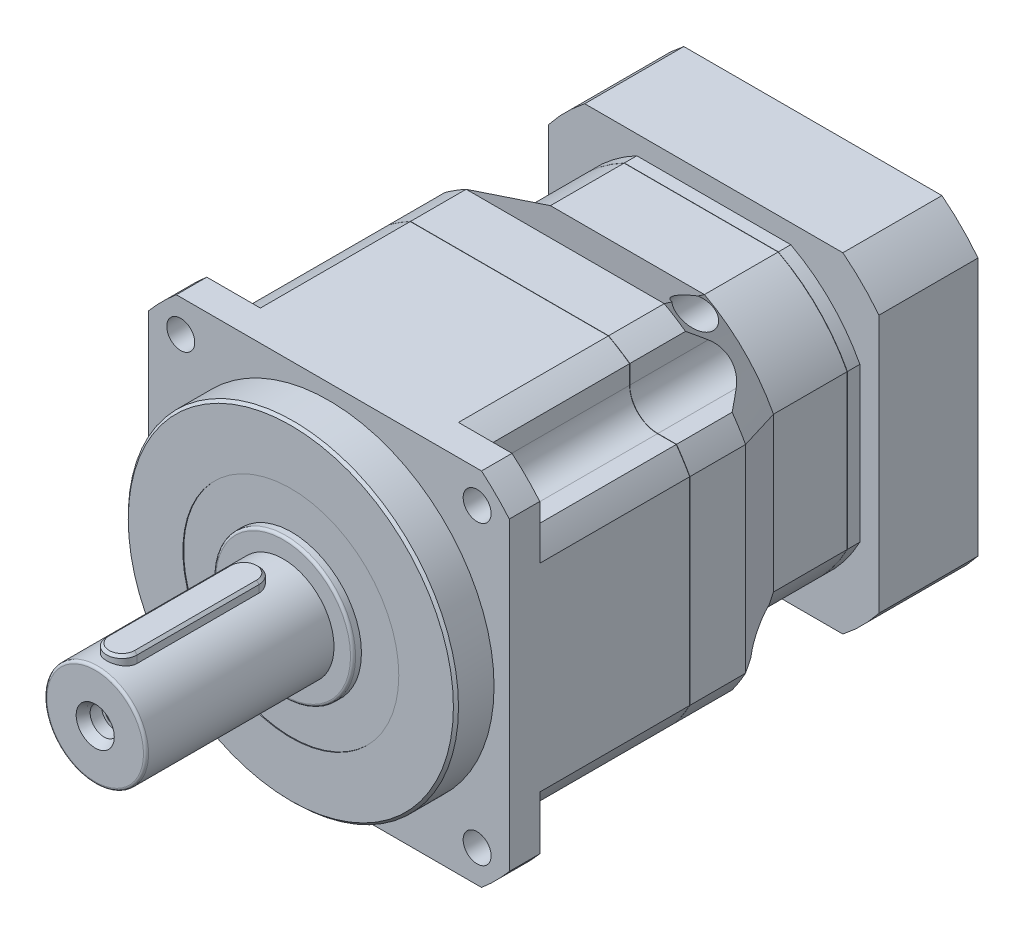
SolidWorks part; units mm, degrees
ref_plane "前视基准面" through (0, 0, 0) normal (0, 0, 1) x (1, 0, 0)
ref_plane "上视基准面" through (0, 0, 0) normal (0, 1, 0) x (1, 0, 0)
ref_plane "右视基准面" through (0, 0, 0) normal (1, 0, 0) x (0, 0, -1)
sketch "草图1" plane through (0, 0, 0) normal (0, 0, 1) x (1, 0, 0)
  line L1 (-60.0666, 71) -> (60.0666, 71)
  line L2 (-71, 60.0666) -> (-71, -60.0666)
  line L3 (-60.0666, -71) -> (60.0666, -71)
  line L4 (71, 60.0666) -> (71, -60.0666)
  arc A0 (-60.0666, 71) -> (-71, 60.0666) centre (0, 0) ccw
  arc A1 (-71, -60.0666) -> (-60.0666, -71) centre (0, 0) ccw
  arc A2 (60.0666, -71) -> (71, -60.0666) centre (0, 0) ccw
  arc A3 (71, 60.0666) -> (60.0666, 71) centre (0, 0) ccw
  dimension "D1" = 71
  dimension "D3" = 71
extrude "凸台-拉伸1" add sketch "草图1" along normal blind 12
sketch "草图2" plane through (0, 0, 12) normal (0, 0, 1) x (1, 0, 0)
  circle A0 centre (0, 0) radius 65
extrude "凸台-拉伸2" add sketch "草图2" along normal blind 15
sketch "草图3" plane through (0, 0, 0) normal (0, 0, -1) x (-1, 0, 0)
  line L0 (-60.0666, 71) -> (60.0666, 71) construction
  line L1 (71, 60.0666) -> (71, -60.0666) construction
  line L2 (60.0666, -71) -> (-60.0666, -71) construction
  line L3 (-71, -60.0666) -> (-71, 60.0666) construction
  line L4 (-38.9872, 71) -> (38.9872, 71)
  line L5 (71, 38.9872) -> (71, -38.9872)
  line L6 (38.9872, -71) -> (-38.9872, -71)
  line L7 (-71, -38.9872) -> (-71, 38.9872)
  arc A0 (-38.9872, 71) -> (-71, 38.9872) centre (0, 0) ccw
  arc A1 (-71, -38.9872) -> (-38.9872, -71) centre (0, 0) ccw
  arc A2 (38.9872, -71) -> (71, -38.9872) centre (0, 0) ccw
  arc A3 (71, 38.9872) -> (38.9872, 71) centre (0, 0) ccw
extrude "凸台-拉伸3" add sketch "草图3" along normal blind 59
sketch "草图4" plane through (0, 0, -59) normal (0, 0, -1) x (-1, 0, 0)
  line L1 (-78.3152, 74.0927) -> (-47.35, 74.0927)
  line L2 (-78.3152, 74.0927) -> (-78.3152, 47.35)
  line L3 (-78.3152, 47.35) -> (-47.35, 47.35)
  line L4 (-47.35, 74.0927) -> (-47.35, 47.35)
  dimension "D1" = 47.35
  dimension "D2" = 47.35
extrude "切除-拉伸1" cut sketch "草图4" against normal up to surface (59 mm away)
pattern_circular "阵列(圆周)1" count 4 over 360 about axis through (0, 0, 0) along (0, 0, 1) of "切除-拉伸1"
fillet "圆角1" radius 11 4 edges at (47.35, -47.35, -29.5) (-47.35, -47.35, -29.5) (-47.35, 47.35, -29.5) (47.35, 47.35, -29.5)
ref_plane "基准面1" through (0, 0, -59.1) normal (0, 0, -1) x (-1, 0, 0)
sketch "草图5" plane through (0, 0, -59.1) normal (0, 0, -1) x (-1, 0, 0)
  line L0 (38.9872, 71) -> (-38.9872, 71) construction
  line L1 (71, -38.9872) -> (71, 38.9872) construction
  line L2 (-38.9872, -71) -> (38.9872, -71) construction
  line L3 (-71, 38.9872) -> (-71, -38.9872) construction
  line L4 (38.9872, 71) -> (-38.9872, 71)
  line L5 (71, -38.9872) -> (71, 38.9872)
  line L6 (-38.9872, -71) -> (38.9872, -71)
  line L7 (-71, 38.9872) -> (-71, -38.9872)
  arc A0 (-38.9872, 71) -> (-71, 38.9872) centre (0, 0) ccw
  arc A1 (-71, -38.9872) -> (-38.9872, -71) centre (0, 0) ccw
  arc A2 (38.9872, -71) -> (71, -38.9872) centre (0, 0) ccw
  arc A3 (71, 38.9872) -> (38.9872, 71) centre (0, 0) ccw
extrude "凸台-拉伸4" add sketch "草图5" along normal blind 21.9 separate body
ref_plane "基准面4" through (0, 0, -105.5) normal (0, 0, -1) x (-1, 0, 0)
sketch "草图25" plane through (0, 0, -105.5) normal (0, 0, -1) x (-1, 0, 0)
  line L1 (-30.3109, 57.5) -> (30.3109, 57.5)
  line L2 (-57.5, 30.3109) -> (-57.5, -30.3109)
  line L3 (-30.3109, -57.5) -> (30.3109, -57.5)
  line L4 (57.5, 30.3109) -> (57.5, -30.3109)
  arc A0 (-30.3109, 57.5) -> (-57.5, 30.3109) centre (0, 0) ccw
  arc A1 (-57.5, -30.3109) -> (-30.3109, -57.5) centre (0, 0) ccw
  arc A2 (30.3109, -57.5) -> (57.5, -30.3109) centre (0, 0) ccw
  arc A3 (57.5, 30.3109) -> (30.3109, 57.5) centre (0, 0) ccw
  dimension "D1" = 57.5
  dimension "D3" = 57.5
extrude "凸台-拉伸12" add sketch "草图25" along normal blind 29 separate body
loft "放样1" add
sketch "草图6" plane through (0, 0, -59.1) normal (0, 0, 1) x (1, 0, 0)
  line L0 (58.35, -47.35) -> (65.7189, -47.35) construction
  line L1 (47.35, -65.7189) -> (47.35, -58.35) construction
  line L2 (58.35, -47.35) -> (65.7189, -47.35)
  line L3 (47.35, -65.7189) -> (47.35, -58.35)
  arc A0 (58.35, -47.35) -> (47.35, -58.35) centre (58.35, -58.35) ccw construction
  arc A1 (58.35, -47.35) -> (47.35, -58.35) centre (58.35, -58.35) ccw
  arc A2 (47.35, -65.7189) -> (65.7189, -47.35) centre (0, 0) ccw
extrude "切除-拉伸2" cut sketch "草图6" against normal blind 50
pattern_circular "阵列(圆周)2" count 4 over 360 about axis through (0, 0, 0) along (0, 0, 1) of "切除-拉伸2"
ref_plane "基准面2" through (0, 0, -134.6) normal (0, 0, -1) x (-1, 0, 0)
sketch "草图7" plane through (0, 0, -134.6) normal (0, 0, -1) x (-1, 0, 0)
  line L1 (-30.3109, 57.5) -> (30.3109, 57.5)
  line L2 (-57.5, 30.3109) -> (-57.5, -30.3109)
  line L3 (-30.3109, -57.5) -> (30.3109, -57.5)
  line L4 (57.5, 30.3109) -> (57.5, -30.3109)
  arc A0 (-30.3109, 57.5) -> (-57.5, 30.3109) centre (0, 0) ccw
  arc A1 (-57.5, -30.3109) -> (-30.3109, -57.5) centre (0, 0) ccw
  arc A2 (30.3109, -57.5) -> (57.5, -30.3109) centre (0, 0) ccw
  arc A3 (57.5, 30.3109) -> (30.3109, 57.5) centre (0, 0) ccw
  dimension "D5" = 115
  dimension "D2" = 65
  dimension "D1" = 57.5
  dimension "D3" = 57.5
  dimension "D4" = 57.5
extrude "凸台-拉伸5" add sketch "草图7" along normal blind 4.9 separate body
sketch "草图8" plane through (0, 0, -139.5) normal (0, 0, -1) x (-1, 0, 0)
  line L1 (-65, 65) -> (65, 65)
  line L2 (-65, 65) -> (-65, -65)
  line L3 (-65, -65) -> (65, -65)
  line L4 (65, 65) -> (65, -65)
  dimension "D1" = 65
  dimension "D2" = 130
  dimension "D3" = 65
  dimension "D4" = 130
extrude "凸台-拉伸6" add sketch "草图8" along normal blind 39
sketch "草图9" plane through (0, 0, -178.5) normal (0, 0, -1) x (-1, 0, 0)
  circle A0 centre (0, 0) radius 82.5
extrude "切除-拉伸3" cut sketch "草图9" against normal up to surface (39 mm away) flip side to cut
sketch "草图10" plane through (0, 0, -178.5) normal (0, 0, -1) x (-1, 0, 0)
  circle A0 centre (0, 0) radius 55
extrude "切除-拉伸4" cut sketch "草图10" against normal blind 11
sketch "草图26" plane through (0, 0, -167.5) normal (0, 0, -1) x (-1, 0, 0)
  circle A0 centre (0, 0) radius 54.5
extrude "切除-拉伸12" cut sketch "草图26" against normal blind 8.5
sketch "草图27" plane through (0, 0, -178.5) normal (0, 0, -1) x (-1, 0, 0)
  line L0 (0, 0) -> (0, -47.5) construction
  line L1 (0, 0) -> (-25.1712, -40.2823) construction
  circle A0 centre (0, 0) radius 47.5 construction
  circle A1 centre (-25.1712, -40.2823) radius 7
  dimension "D1" = 32
extrude "切除-拉伸13" cut sketch "草图27" against normal blind 32.5
pattern_circular "阵列(圆周)7" count 6 over 360 about axis through (0, 0, 0) along (0, 0, 1) of "切除-拉伸13"
sketch "草图28" plane through (0, 0, -159) normal (0, 0, -1) x (-1, 0, 0)
  circle A0 centre (0, 0) radius 37
extrude "切除-拉伸14" cut sketch "草图28" against normal blind 21
ref_plane "基准面5" through (0, 0, -158.5) normal (0, 0, -1) x (-1, 0, 0)
sketch "草图29" plane through (0, 0, -158.5) normal (0, 0, -1) x (-1, 0, 0)
  circle A0 centre (0, 0) radius 32
extrude "凸台-拉伸13" add sketch "草图29" against normal up to surface (20.5 mm away)
chamfer "倒角4" distance 1.5 angle 45 1 edges at (-32, 0, -158.5)
sketch "草图30" plane through (0, 0, -178.5) normal (0, 0, -1) x (-1, 0, 0)
  circle A0 centre (0, 0) radius 12
extrude "切除-拉伸15" cut sketch "草图30" against normal blind 65.5
sketch "草图31" plane through (0, 0, -158.5) normal (0, 0, -1) x (-1, 0, 0)
  line L1 (-33.8172, 0.5) -> (34.9458, 0.5)
  line L2 (-33.8172, 0.5) -> (-33.8172, -0.5)
  line L3 (-33.8172, -0.5) -> (34.9458, -0.5)
  line L4 (34.9458, 0.5) -> (34.9458, -0.5)
  dimension "D1" = 0.5
  dimension "D2" = 1
extrude "切除-拉伸16" cut sketch "草图31" against normal up to surface (20.5 mm away)
sketch "草图32" plane through (0, 0, -146) normal (0, 0, -1) x (-1, 0, 0)
  line L1 (-45.8791, 4.7344) -> (-49.3395, 4.5747)
  line L2 (-49.3395, 4.5747) -> (-50.9315, 1.4981)
  line L3 (-50.9315, 1.4981) -> (-49.063, -1.4189)
  line L4 (-49.063, -1.4189) -> (-45.6026, -1.2593)
  line L5 (-45.6026, -1.2593) -> (-44.0106, 1.8174)
  line L6 (-44.0106, 1.8174) -> (-45.8791, 4.7344)
  circle A0 centre (-47.4711, 1.6577) radius 6
  circle A1 centre (-47.4711, 1.6577) radius 3 construction
  dimension "D1" = 6
extrude "凸台-拉伸14" add sketch "草图32" along normal blind 7
sketch "草图33" plane through (0, 0, -178.5) normal (0, 0, -1) x (-1, 0, 0)
  line L0 (0, 0) -> (-51.2652, 51.2652) construction
  circle A0 centre (0, 0) radius 72.5 construction
pattern_circular "阵列(圆周)8" count 6 over 360 about axis through (0, 0, 0) along (0, 0, 1) of "凸台-拉伸14"
hole_wizard "M8 螺纹孔1" positions "3D草图2" profile "草图34" tap size "M8" standard "GB"
sketch3d "3D草图2"
  point P0 (51.2652, 51.2652, -178.5)
sketch "草图34" plane through (51.2652, 51.2652, -178.5) normal (1, 0, 0) x (0, 1, 0)
  line L0 (0, 0) -> (0, 30.0429)
  line L1 (0, 30.0429) -> (3.4, 28)
  line L2 (3.4, 28) -> (3.4, 0)
  line L5 (3.4, 0) -> (0, 0)
  line L10 (0, 30.0429) -> (-3.4, 28) construction
  line L11 (0, -6.35) -> (0, 107.95) construction
  dimension "螺纹孔钻头直径" = 6.8
  dimension "螺纹孔钻头深度" = 28
  dimension "导头角度" = 118
pattern_circular "阵列(圆周)9" count 4 over 360 about axis through (0, 0, 0) along (0, 0, 1) of "M8 螺纹孔1"
chamfer "倒角2" distance 1 angle 45 1 edges at (65, 0, 27)
sketch "草图19" plane through (0, 0, 12) normal (0, 0, 1) x (1, 0, 0)
  line L0 (0, 0) -> (-65.7609, 65.7609) construction
  circle A0 centre (0, 0) radius 82.5 construction
  arc A1 (-60.0666, 71) -> (-71, 60.0666) centre (0, 0) ccw construction
  circle A2 centre (-58.3363, 58.3363) radius 5.5
extrude "切除-拉伸10" cut sketch "草图19" against normal blind 83.5
pattern_circular "阵列(圆周)5" count 4 over 360 about axis through (0, 0, 0) along (0, 0, 1) of "切除-拉伸10"
sketch "草图20" plane through (0, 0, 27) normal (0, 0, 1) x (1, 0, 0)
  circle A0 centre (0, 0) radius 27.5
extrude "凸台-拉伸8" add sketch "草图20" along normal blind 3
fillet "圆角3" radius 1 1 edges at (27.5, 0, 30)
sketch "草图21" plane through (0, 0, 30) normal (0, 0, 1) x (1, 0, 0)
  circle A0 centre (0, 0) radius 20
extrude "凸台-拉伸9" add sketch "草图21" along normal blind 74
fillet "圆角4" radius 1 1 edges at (20, 0, 104)
sketch "草图22" plane through (0, 0, 27) normal (0, 0, 1) x (1, 0, 0)
  circle A0 centre (0, 0) radius 42.5
  circle A1 centre (0, 0) radius 27.5
extrude "切除-拉伸11" cut sketch "草图22" against normal blind 0.3
sketch "草图23" plane through (0, 0, 0) normal (0, 1, 0) x (1, 0, 0)
  line L0 (-19, -104) -> (19, -104) construction
  line L1 (-6, -93.5) -> (-6, -45.5)
  line L2 (6, -45.5) -> (6, -93.5)
  arc A0 (-6, -93.5) -> (6, -93.5) centre (0, -93.5) ccw
  arc A1 (6, -45.5) -> (-6, -45.5) centre (0, -45.5) ccw
  dimension "D1" = 10.5
  dimension "D2" = 48
extrude "凸台-拉伸10" add sketch "草图23" along normal blind 23
chamfer "倒角3" distance 1 angle 45 4 edges at (-6, 23, 69.5) (0, 23, 99.5) (0, 23, 39.5) (6, 23, 69.5)
ref_plane "基准面6" through (0, 0, -73) normal (0, 0, -1) x (-1, 0, 0)
sketch "草图35" plane through (0, 0, -73) normal (0, 0, -1) x (-1, 0, 0)
  line L0 (0, 0) -> (0, 72.5) construction
  line L1 (0, 0) -> (-38.4191, 61.4835) construction
  circle A0 centre (0, 0) radius 72.5 construction
  circle A1 centre (-38.4191, 61.4835) radius 7
  dimension "D1" = 32
extrude "切除-拉伸17" cut sketch "草图35" along normal blind 60
pattern_circular "阵列(圆周)10" count 4 over 360 about axis through (0, 0, 0) along (0, 0, 1) of "切除-拉伸17"
sketch "草图36" plane through (0, 0, 104) normal (0, 0, 1) x (1, 0, 0)
  circle A0 centre (0, 0) radius 5.5
extrude "切除-拉伸18" cut sketch "草图36" against normal blind 8
ref_plane "基准面7" through (0, 0, 100.5) normal (0, 0, 1) x (1, 0, 0)
sketch "草图37" plane through (0, 0, 104) normal (0, 0, 1) x (1, 0, 0)
  circle A0 centre (0, 0) radius 7.5
sketch "草图38" plane through (0, 0, 100.5) normal (0, 0, 1) x (1, 0, 0)
  circle A0 centre (0, 0) radius 5.5 construction
  circle A1 centre (0, 0) radius 5.5
loft "切除-放样1" cut profiles "草图37", "草图38"
hole_wizard "M10 螺纹孔1" positions "3D草图3" profile "草图39" tap size "M10" standard "GB"
sketch3d "3D草图3"
  line L0 (0, 0, 96) -> (0, 0, 100.5) construction
  point P0 (0, 0, 96)
sketch "草图39" plane through (0, 0, 96) normal (1, 0, 0) x (0, -1, 0)
  line L0 (0, 0) -> (0, 29.5537)
  line L1 (0, 29.5537) -> (4.25, 27)
  line L2 (4.25, 27) -> (4.25, 0)
  line L5 (4.25, 0) -> (0, 0)
  line L10 (0, 29.5537) -> (-4.25, 27) construction
  line L11 (0, -6.35) -> (0, 107.95) construction
  dimension "螺纹孔钻头直径" = 8.5
  dimension "螺纹孔钻头深度" = 27
  dimension "导头角度" = 118
